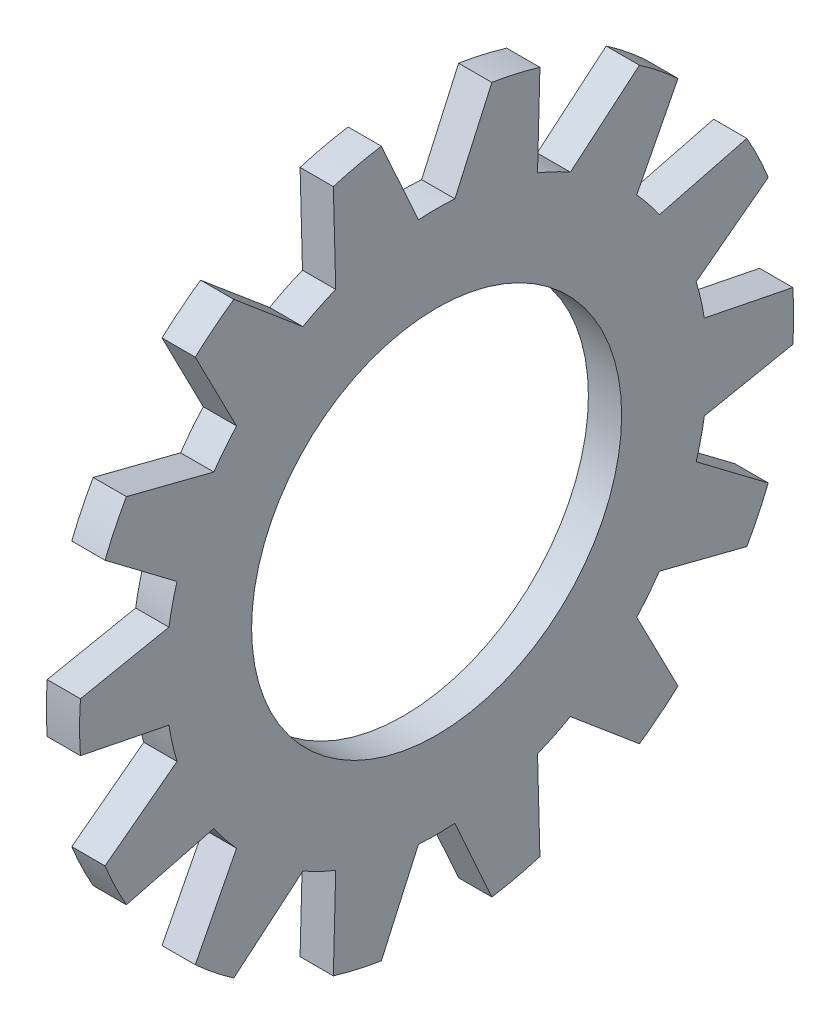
SolidWorks part; units mm, degrees
ref_plane "Plane1" through (0, 0, 0) normal (0, 0, 1) x (1, 0, 0)
ref_plane "Plane2" through (0, 0, 0) normal (0, 1, 0) x (1, 0, 0)
ref_plane "Plane3" through (0, 0, 0) normal (1, 0, 0) x (0, 0, -1)
sketch "SecSke" plane through (0, 0, 0) normal (0, 0, 1) x (1, 0, 0)
  line L0 (-34.925, 0) -> (9.525, 0) construction
  line L1 (0, 3.2512) -> (0, 6.2738)
  line L2 (0, 6.2738) -> (-0.5842, 6.2738)
  line L3 (-0.5842, 6.2738) -> (-0.5842, 3.2512)
  line L4 (-0.5842, 3.2512) -> (0, 3.2512)
  dimension "Thickness" = 0.5842
  dimension "Inside_dia" = 6.5024
  dimension "Outside_dia" = 12.5476
revolve "Body" add sketch "SecSke" angle 360 about L0
sketch "ExtCutSke" plane through (0, 0, 0) normal (1, 0, 0) x (0, 0, -1)
  line L0 (0, 0) -> (0, 6.5875) construction
  line L1 (-1.1034, 6.4944) -> (-0.3204, 4.7517)
  line L2 (1.1034, 6.4944) -> (0.3204, 4.7517)
  arc A0 (1.1034, 6.4944) -> (-1.1034, 6.4944) centre (0, 0) ccw
  arc A1 (0.3204, 4.7517) -> (-0.3204, 4.7517) centre (0, 0) ccw
  dimension "Cut_dia" = 9.525
  dimension "Clr_dia" = 13.175
  dimension "Cut_ang" = 7.714
  dimension "Clr_ang" = 19.286
extrude "ExtCut" cut sketch "ExtCutSke" against normal through all
pattern_circular "ExtCuts" count 14 every 25.714 about axis through (-34.925, 0, 0) along (1, 0, 0) of "ExtCut"
equation "' \"Inside_dia@SecSke\" = 16"
equation "' \"Outside_dia@SecSke\" = 26"
equation "' \"Thickness@SecSke\" = 1.2"
equation "' \"Count@ExtCuts\" = 14"
equation "' \"Inside_dia@SecSke\" = 10.5"
equation "' \"Outside_dia@SecSke\" = 18"
equation "' \"Thickness@SecSke\" = 0.9"
equation "' \"Count@ExtCuts\" = 12"
equation "' \"Inside_dia@SecSke\" = 6.4"
equation "' \"Outside_dia@SecSke\" = 11"
equation "' \"Thickness@SecSke\" = 0.6"
equation "' \"Inside_dia@SecSke\" = 4.3"
equation "' \"Outside_dia@SecSke\" = 8.5"
equation "' \"Thickness@SecSke\" = 0.45"
equation "' \"Count@ExtCuts\" = 9"
equation "\"Angle@ExtCuts\" = 360 / \"Count@ExtCuts\""
equation "\"Clr_dia@ExtCutSke\" =  \"Outside_dia@SecSke\" * 1.05"
equation "\"Cut_dia@ExtCutSke\" = \"Outside_dia@SecSke\" - (\"Outside_dia@SecSke\"  - \"Inside_dia@SecSke\" ) * 0.5"
equation "\"Clr_ang@ExtCutSke\" = (360 / \"Count@ExtCuts\") * 0.75"
equation "\"Cut_ang@ExtCutSke\" = (360 / \"Count@ExtCuts\") * 0.3"
